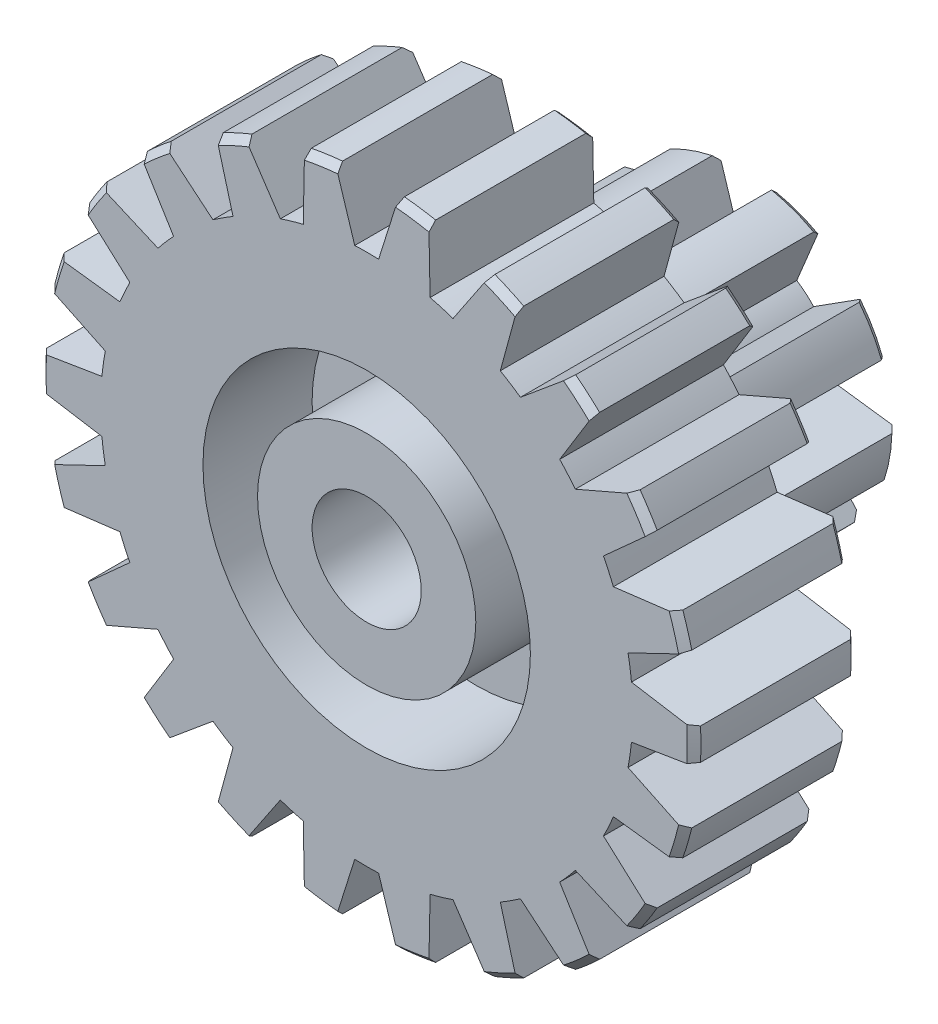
SolidWorks part; units mm, degrees
ref_plane "Plan1" through (0, 0, 0) normal (0, 0, 1) x (1, 0, 0)
ref_plane "Plan2" through (0, 0, 0) normal (0, 1, 0) x (1, 0, 0)
ref_plane "Plan3" through (0, 0, 0) normal (1, 0, 0) x (0, 0, -1)
sketch "Diamètre primitif" plane through (0, 0, 0) normal (0, 0, 1) x (1, 0, 0)
  line L0 (0, 0) -> (0.5, 0) construction
  circle A0 centre (0, 0) radius 5.5
  point P3 (0, 0)
  dimension "D1" = 11
  dimension "D2" = 0.5
sketch "Esquisse2" plane through (0, 0, 0) normal (0, 0, 1) x (1, 0, 0)
  circle A0 centre (0, 0) radius 6
  dimension "D1" = 12
extrude "Diamètre de tête" add sketch "Esquisse2" along normal mid plane 3
chamfer "Chanfreins" distance 0.125 angle 45
sketch "Esquisse3" plane through (0, 0, 0) normal (0, 0, 1) x (1, 0, 0)
  line L0 (0, 0) -> (0, 6) construction
  line L1 (-0.2188, 4.8701) -> (-0.5666, 5.9732)
  line L2 (0.2188, 4.8701) -> (0.5666, 5.9732)
  arc A0 (0.2188, 4.8701) -> (-0.2188, 4.8701) centre (0, 0) ccw
  circle A1 centre (0, 0) radius 6 construction
  arc A2 (0.5666, 5.9732) -> (-0.5666, 5.9732) centre (0, 0) ccw
  point P1 (-0.3927, 5.4216)
  point P10 (0.3927, 5.4216)
  dimension "D1" = 9.75
  dimension "D2" = 0.7854
  dimension "D3" = 325
extrude "Creux dent" cut sketch "Esquisse3" against normal through all and the other way through all
pattern_circular "Répétition" count 22 over 360
sketch "Esquisse5" plane through (0, 0, -1.5) normal (0, 0, -1) x (-1, 0, 0)
  circle A0 centre (0, 0) radius 2
  dimension "D1" = 4
extrude "Extrusion1" add sketch "Esquisse5" along normal blind 4
ref_plane "Plan pignon" through (0, 0, -5.5) normal (0, 0, -1) x (-1, 0, 0)
sketch "Primitif" plane through (0, 0, -5.5) normal (0, 0, -1) x (-1, 0, 0)
  line L0 (0, 0) -> (0.5, 0) construction
  circle A0 centre (0, 0) radius 2.25
  dimension "D1" = 4.5
  dimension "D2" = 0.5
sketch "Esquisse31" plane through (0, 0, -5.5) normal (0, 0, -1) x (-1, 0, 0)
  circle A0 centre (0, 0) radius 2.75
  dimension "D1" = 5.5
extrude "Pignon" add sketch "Esquisse31" against normal up to surface (4 mm away)
chamfer "Chanfreins1" distance 0.125 angle 45
sketch "Esquisse41" plane through (0, 0, -5.5) normal (0, 0, -1) x (-1, 0, 0)
  line L0 (0, 0) -> (0, 2.75) construction
  line L1 (-0.2025, 1.6123) -> (-0.5441, 2.6956)
  line L2 (0.2025, 1.6123) -> (0.5441, 2.6956)
  arc A0 (0.2025, 1.6123) -> (-0.2025, 1.6123) centre (0, 0) ccw
  circle A1 centre (0, 0) radius 2.75 construction
  arc A2 (0.5441, 2.6956) -> (-0.5441, 2.6956) centre (0, 0) ccw
  circle A4 centre (0, 0) radius 2.25 construction
  point P1 (-0.3927, 2.2155)
  point P10 (0.3927, 2.2155)
  dimension "D1" = 3.25
  dimension "D2" = 0.7854
  dimension "D3" = 35
extrude "Creux dent1" cut sketch "Esquisse41" against normal up to surface (4 mm away)
pattern_circular "Répétition circulaire1" count 9 over 360
sketch "Esquisse4" plane through (0, 0, 1.5) normal (0, 0, 1) x (1, 0, 0)
  circle A0 centre (0, 0) radius 1
  dimension "D1" = 2
extrude "Enlèv. mat.-Extru.1" cut sketch "Esquisse4" against normal through all
sketch "Esquisse42" plane through (0, 0, 1.5) normal (0, 0, 1) x (1, 0, 0)
  circle A0 centre (0, 0) radius 2.5
  dimension "D1" = 5
extrude "Enlèv. de mat.-Extru.-Mince2" cut sketch "Esquisse42" against normal blind 2 thin
equation "\"D1@Esquisse2\" = \"D1@Diamètre primitif\" + 2 * \"D2@Diamètre primitif\""
equation "\"D1@Chanfreins\" = 0.25*\"D2@Diamètre primitif\""
equation "\"D1@Esquisse3\" = \"D1@Diamètre primitif\"-2.5*\"D2@Diamètre primitif\""
equation "\"D2@Esquisse3\"=3.14159*\"D2@Diamètre primitif\"/2"
equation "\"D1@Répétition\" = \"D1@Diamètre primitif\"/\"D2@Diamètre primitif\""
equation "\"D1@Esquisse31\" = \"D1@Primitif\"+2*\"D2@Primitif\""
equation "\"D1@Chanfreins1\" = 0.25*\"D2@Primitif\""
equation "\"D1@Esquisse41\" = \"D1@Primitif\"-2.5*\"D2@Primitif\""
equation "\"D2@Esquisse41\" = 3.14159/2*\"D2@Primitif\""
equation "\"D1@Répétition circulaire1\"=\"D1@Primitif\"/\"D2@Primitif\""
